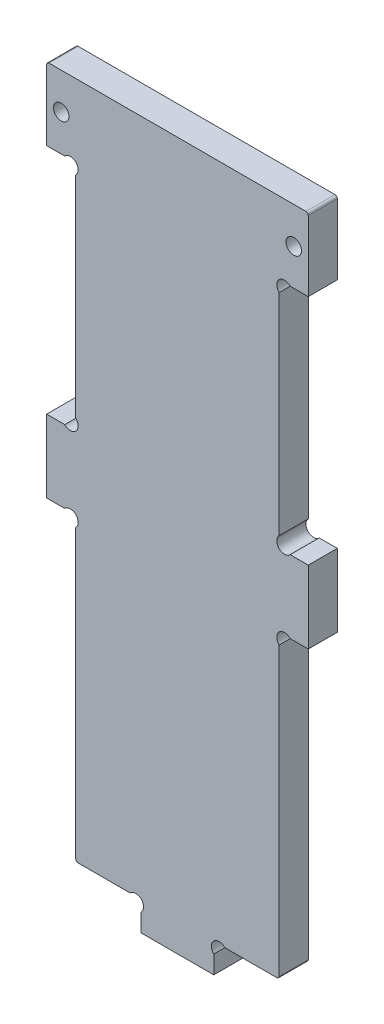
SolidWorks part; units mm, degrees
ref_plane "Plan de face" through (0, 0, 0) normal (0, 0, 1) x (1, 0, 0)
ref_plane "Plan de dessus" through (0, 0, 0) normal (0, 1, 0) x (1, 0, 0)
ref_plane "Plan de droite" through (0, 0, 0) normal (1, 0, 0) x (0, 0, -1)
sketch "Esquisse1" plane through (0, 0, 0) normal (0, 0, 1) x (1, 0, 0)
  line L0 (-50, 85.2122) -> (-50, -96.308) construction
  line L1 (-23, 85.2122) -> (-23, -92.499) construction
  line L2 (-29, 85.2122) -> (-29, -90.5017) construction
  line L3 (-78.5033, 70) -> (56.6025, 70) construction
  line L4 (19, 73.8637) -> (19, -85.8392) construction
  line L5 (-41.4418, -8) -> (29.7548, -8) construction
  line L6 (-81.5356, 55) -> (70.7532, 55) construction
  line L7 (-42.5, -66.0658) -> (-42.5, -82.812) construction
  line L8 (-76.5, 70) -> (-23.5, 70)
  line L9 (-23, 69.5) -> (-23, 55)
  line L10 (-23, 55) -> (-26.7381, 55)
  line L11 (0, -62.2943) -> (0, -82.812) construction
  line L12 (-29, 52.7381) -> (-29, 9.2619)
  line L13 (-26.7381, 7) -> (-23, 7)
  line L14 (-23, 7) -> (-23, -8)
  line L15 (-23.6471, -0.5) -> (-34.0001, -0.5) construction
  line L16 (-23, -8) -> (-26.7381, -8)
  line L17 (-29, -10.2619) -> (-29, -69.5)
  line L18 (-29.5, -70) -> (-40.2381, -70)
  line L19 (-42.5, -72.2619) -> (-42.5, -76)
  line L20 (-42.5, -76) -> (-57.5, -76)
  line L21 (-57.5, -72.2619) -> (-57.5, -76)
  line L22 (-70.5, -70) -> (-59.7619, -70)
  line L23 (-71, -10.2619) -> (-71, -69.5)
  line L24 (-77, -8) -> (-73.2619, -8)
  line L25 (25, 71.9337) -> (25, -94.7029) construction
  line L26 (-77, 7) -> (-77, -8)
  line L27 (-41.4418, 7) -> (36.6752, 7) construction
  line L28 (-73.2619, 7) -> (-77, 7)
  line L29 (-71, 52.7381) -> (-71, 9.2619)
  line L30 (-77, 55) -> (-73.2619, 55)
  line L31 (-77, 69.5) -> (-77, 55)
  line L35 (1.1753, -40) -> (40, -40) construction
  line L37 (19, -70) -> (-85.5586, -70) construction
  arc A0 (-26.7381, 55) -> (-29, 52.7381) centre (-27.9, 53.9) ccw
  circle A1 centre (-26, 62.5) radius 1.6
  circle A2 centre (-26, -0.5) radius 1.6 construction
  arc A3 (-59.7619, -70) -> (-57.5, -72.2619) centre (-58.6, -71.1) cw
  arc A4 (-29, 9.2619) -> (-26.7381, 7) centre (-27.9, 8.1) ccw
  arc A5 (-29, -10.2619) -> (-26.7381, -8) centre (-27.9, -9.1) cw
  arc A6 (-40.2381, -70) -> (-42.5, -72.2619) centre (-41.4, -71.1) ccw
  arc A7 (-23.5, 70) -> (-23, 69.5) centre (-23.5, 69.5) cw
  arc A8 (-29, -69.5) -> (-29.5, -70) centre (-29.5, -69.5) cw
  arc A9 (-71, -69.5) -> (-70.5, -70) centre (-70.5, -69.5) ccw
  circle A10 centre (-74, -0.5) radius 1.6 construction
  arc A11 (-71, -10.2619) -> (-73.2619, -8) centre (-72.1, -9.1) ccw
  arc A12 (-71, 9.2619) -> (-73.2619, 7) centre (-72.1, 8.1) cw
  arc A13 (-73.2619, 55) -> (-71, 52.7381) centre (-72.1, 53.9) cw
  circle A14 centre (-74, 62.5) radius 1.6
  arc A15 (-76.5, 70) -> (-77, 69.5) centre (-76.5, 69.5) ccw
  point P52 (-23, 70)
  point P65 (-29, -70)
  point P73 (-50, 70)
  point P80 (-50, -76)
  point P83 (-50, 70)
  point P88 (-50, -76)
  dimension "D5" = 7.5
  dimension "D10" = 1.1
  dimension "D12" = 1.1
  dimension "D14" = 0.5
  dimension "D15" = 7.5
  dimension "D16" = 3
  dimension "D6" = 1.1
  dimension "D8" = 1.6
  dimension "D17" = 7.5
  dimension "D9" = 1.1
  dimension "D1" = 27
  dimension "D2" = 6
  dimension "D3" = 125
  dimension "D4" = 140
  dimension "D7" = 1.1
  dimension "D11" = 3
  dimension "D13" = 1.1
extrude "Extrusion1" add sketch "Esquisse1" against normal blind 6
